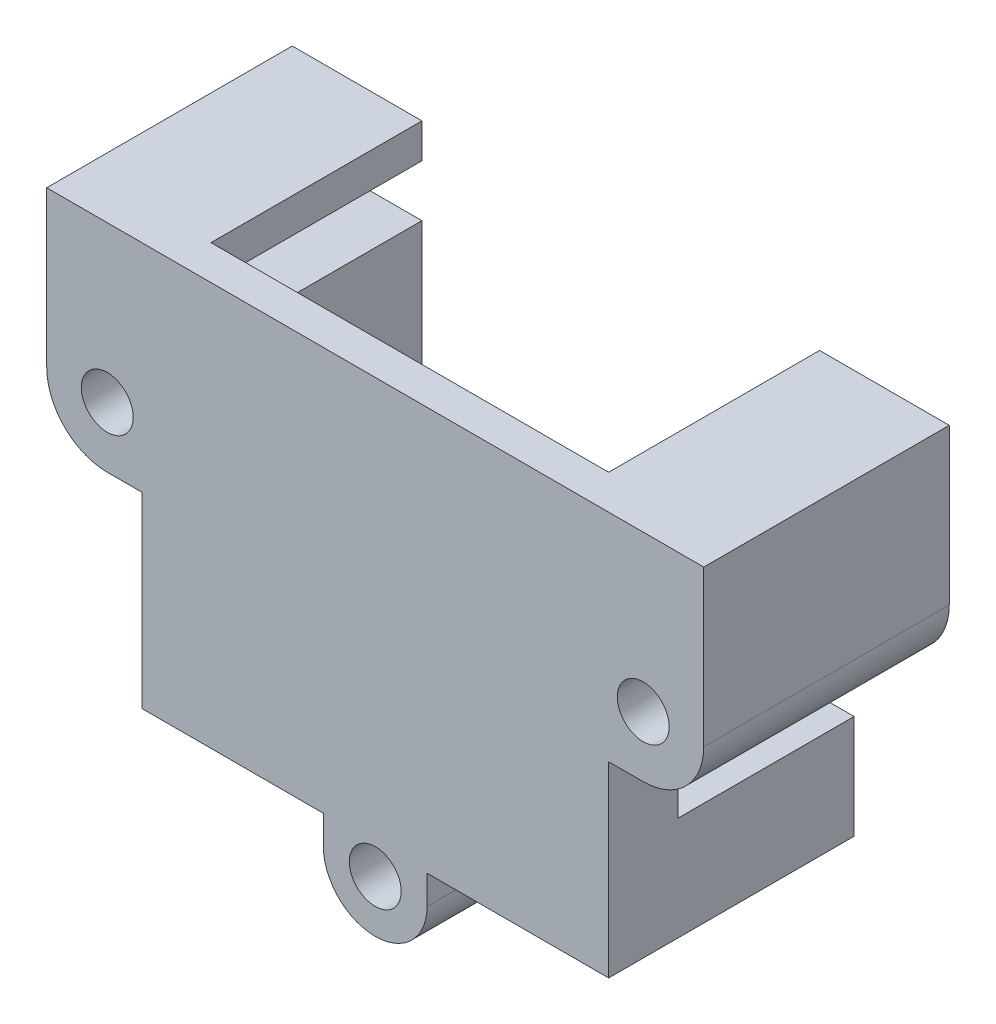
SolidWorks part; units mm, degrees
ref_plane "Alzado" through (0, 0, 0) normal (0, 0, 1) x (1, 0, 0)
ref_plane "Planta" through (0, 0, 0) normal (0, 1, 0) x (1, 0, 0)
ref_plane "Vista lateral" through (0, 0, 0) normal (1, 0, 0) x (0, 0, -1)
sketch "Croquis1" plane through (0, 0, 0) normal (0, 0, 1) x (1, 0, 0)
  line L22 (11.5, 17.5) -> (11.5, 8.5)
  line L23 (17, 17.5) -> (11.5, 17.5)
  line L24 (17, 20.5) -> (17, 17.5)
  line L25 (19, 15.5) -> (19, 20.5)
  line L26 (17.5, 15.5) -> (19, 15.5)
  line L27 (17.5, 13.5) -> (17.5, 15.5)
  line L28 (13.5, 11.5) -> (15.5, 11.5)
  line L29 (11.5, 8.5) -> (13.5, 8.5)
  line L30 (-17, 17.5) -> (-17, 20.5)
  line L31 (-11.5, 17.5) -> (-17, 17.5)
  line L32 (-11.5, 0.5) -> (-11.5, 17.5)
  line L33 (11.5, 0.5) -> (-11.5, 0.5)
  line L34 (11.5, 5.1667) -> (11.5, 0.5)
  line L35 (13.5, 5.1667) -> (11.5, 5.1667)
  line L36 (13.5, -0.8333) -> (13.5, 5.1667)
  line L37 (1.8856, -0.8333) -> (13.5, -0.8333)
  line L38 (-13.5, -0.8333) -> (-1.8856, -0.8333)
  line L39 (-13.5, 11.5) -> (-13.5, -0.8333)
  line L40 (-15.5, 11.5) -> (-13.5, 11.5)
  line L41 (-17.5, 15.5) -> (-17.5, 13.5)
  line L42 (-19, 15.5) -> (-17.5, 15.5)
  line L43 (-19, 20.5) -> (-19, 15.5)
  line L44 (-19, 20.5) -> (-19, 22.5)
  line L46 (-19, 22.5) -> (-11.5, 22.5)
  line L47 (-11.5, 22.5) -> (-11.5, 20.5)
  line L48 (-11.5, 20.5) -> (-17, 20.5)
  line L49 (19, 20.5) -> (19, 22.5)
  line L51 (19, 22.5) -> (11.5, 22.5)
  line L52 (11.5, 22.5) -> (11.5, 20.5)
  line L53 (11.5, 20.5) -> (17, 20.5)
  line L54 (13.5, 11.5) -> (13.5, 8.5)
  arc A3 (15.5, 11.5) -> (17.5, 13.5) centre (15.5, 13.5) ccw
  arc A4 (-1.8856, -0.8333) -> (1.8856, -0.8333) centre (0, -1.5) ccw
  arc A5 (-17.5, 13.5) -> (-15.5, 11.5) centre (-15.5, 13.5) ccw
  circle A9 centre (15.5, 13.5) radius 1
  circle A10 centre (0, -1.5) radius 1
  circle A11 centre (-15.5, 13.5) radius 1
extrude "Saliente-Extruir1" add sketch "Croquis1" along normal blind 8
sketch "Croquis3" plane through (0, 0, 8) normal (0, 0, 1) x (1, 0, 0)
  line L0 (19, 22.5) -> (11.5, 22.5) construction
  line L1 (19, 15.5) -> (19, 22.5) construction
  line L2 (17.5, 15.5) -> (19, 15.5) construction
  line L3 (17.5, 13.5) -> (17.5, 15.5) construction
  line L4 (13.5, 11.5) -> (15.5, 11.5) construction
  line L5 (13.5, 8.5) -> (13.5, 11.5) construction
  line L6 (13.5, -0.8333) -> (13.5, 5.1667) construction
  line L7 (1.8856, -0.8333) -> (13.5, -0.8333) construction
  line L8 (-13.5, -0.8333) -> (-1.8856, -0.8333) construction
  line L9 (-13.5, 11.5) -> (-13.5, -0.8333) construction
  line L10 (-15.5, 11.5) -> (-13.5, 11.5) construction
  line L11 (-17.5, 15.5) -> (-17.5, 13.5) construction
  line L12 (-19, 15.5) -> (-17.5, 15.5) construction
  line L13 (-19, 22.5) -> (-19, 15.5) construction
  line L14 (-11.5, 22.5) -> (-19, 22.5) construction
  line L15 (19, 22.5) -> (11.5, 22.5)
  line L16 (19, 15.5) -> (19, 22.5)
  line L17 (17.5, 15.5) -> (19, 15.5)
  line L18 (17.5, 13.5) -> (17.5, 15.5)
  line L19 (13.5, 11.5) -> (15.5, 11.5)
  line L20 (13.5, 8.5) -> (13.5, 11.5)
  line L21 (13.5, -0.8333) -> (13.5, 5.1667)
  line L22 (1.8856, -0.8333) -> (13.5, -0.8333)
  line L23 (-13.5, -0.8333) -> (-1.8856, -0.8333)
  line L24 (-13.5, 11.5) -> (-13.5, -0.8333)
  line L25 (-15.5, 11.5) -> (-13.5, 11.5)
  line L26 (-17.5, 15.5) -> (-17.5, 13.5)
  line L27 (-19, 15.5) -> (-17.5, 15.5)
  line L28 (-19, 22.5) -> (-19, 15.5)
  line L29 (-11.5, 22.5) -> (-19, 22.5)
  line L30 (-11.5, 22.5) -> (11.5, 22.5)
  line L31 (13.5, 8.5) -> (13.5, 5.1667)
  circle A0 centre (15.5, 13.5) radius 1 construction
  circle A1 centre (0, -1.5) radius 1 construction
  circle A2 centre (-15.5, 13.5) radius 1 construction
  arc A3 (15.5, 11.5) -> (17.5, 13.5) centre (15.5, 13.5) ccw construction
  arc A4 (-1.8856, -0.8333) -> (1.8856, -0.8333) centre (0, -1.5) ccw construction
  arc A5 (-17.5, 13.5) -> (-15.5, 11.5) centre (-15.5, 13.5) ccw construction
  circle A6 centre (15.5, 13.5) radius 1
  circle A7 centre (0, -1.5) radius 1
  circle A8 centre (-15.5, 13.5) radius 1
  arc A9 (15.5, 11.5) -> (17.5, 13.5) centre (15.5, 13.5) ccw
  arc A10 (-1.8856, -0.8333) -> (1.8856, -0.8333) centre (0, -1.5) ccw
  arc A11 (-17.5, 13.5) -> (-15.5, 11.5) centre (-15.5, 13.5) ccw
extrude "Saliente-Extruir2" add sketch "Croquis3" along normal blind 2
sketch "Croquis5" plane through (0, 0, 8) normal (0, 0, -1) x (-1, 0, 0)
  line L0 (-11.5, 8.5) -> (-11.5, 5.1667)
  line L1 (-11.5, 5.1667) -> (-13.5, 5.1667)
  line L2 (-13.5, 5.1667) -> (-13.5, 8.5)
  line L3 (-13.5, 8.5) -> (-11.5, 8.5)
extrude "Saliente-Extruir3" add sketch "Croquis5" along normal blind 2
sketch "Croquis6" plane through (0, 0, 0) normal (0, 0, -1) x (-1, 0, 0)
  line L0 (17, 17.5) -> (11.5, 17.5) construction
  line L1 (11.5, 17.5) -> (11.5, 0.5) construction
  line L2 (11.5, 0.5) -> (-11.5, 0.5) construction
  line L3 (-11.5, 0.5) -> (-11.5, 5.1667) construction
  line L4 (-11.5, 5.1667) -> (-13.5, 5.1667) construction
  line L5 (-13.5, 5.1667) -> (-13.5, -0.8333) construction
  line L6 (-13.5, -0.8333) -> (-1.8856, -0.8333) construction
  line L7 (1.8856, -0.8333) -> (13.5, -0.8333) construction
  line L8 (13.5, -0.8333) -> (13.5, 11.5) construction
  line L9 (13.5, 11.5) -> (15.5, 11.5) construction
  line L10 (17.5, 13.5) -> (17.5, 15.5) construction
  line L11 (17.5, 15.5) -> (19, 15.5) construction
  line L12 (19, 15.5) -> (19, 22.5) construction
  line L13 (19, 22.5) -> (11.5, 22.5) construction
  line L14 (11.5, 22.5) -> (11.5, 20.5) construction
  line L15 (11.5, 20.5) -> (17, 20.5) construction
  line L16 (17, 20.5) -> (17, 17.5) construction
  line L17 (-11.5, 17.5) -> (-17, 17.5) construction
  line L18 (-17, 17.5) -> (-17, 20.5) construction
  line L19 (-17, 20.5) -> (-11.5, 20.5) construction
  line L20 (-11.5, 20.5) -> (-11.5, 22.5) construction
  line L21 (-11.5, 22.5) -> (-19, 22.5) construction
  line L22 (-19, 22.5) -> (-19, 15.5) construction
  line L23 (-19, 15.5) -> (-17.5, 15.5) construction
  line L24 (-17.5, 15.5) -> (-17.5, 13.5) construction
  line L25 (-15.5, 11.5) -> (-13.5, 11.5) construction
  line L26 (-13.5, 11.5) -> (-13.5, 8.5) construction
  line L27 (-13.5, 8.5) -> (-11.5, 8.5) construction
  line L28 (-11.5, 8.5) -> (-11.5, 17.5) construction
  line L29 (17, 17.5) -> (11.5, 17.5)
  line L30 (11.5, 17.5) -> (11.5, 0.5)
  line L31 (11.5, 0.5) -> (-11.5, 0.5)
  line L32 (-11.5, 0.5) -> (-11.5, 5.1667)
  line L33 (-11.5, 5.1667) -> (-13.5, 5.1667)
  line L34 (-13.5, 5.1667) -> (-13.5, -0.8333)
  line L35 (-13.5, -0.8333) -> (-1.8856, -0.8333)
  line L36 (1.8856, -0.8333) -> (13.5, -0.8333)
  line L37 (13.5, -0.8333) -> (13.5, 11.5)
  line L38 (13.5, 11.5) -> (15.5, 11.5)
  line L39 (17.5, 13.5) -> (17.5, 15.5)
  line L40 (17.5, 15.5) -> (19, 15.5)
  line L41 (19, 15.5) -> (19, 22.5)
  line L42 (19, 22.5) -> (11.5, 22.5)
  line L43 (11.5, 22.5) -> (11.5, 20.5)
  line L44 (11.5, 20.5) -> (17, 20.5)
  line L45 (17, 20.5) -> (17, 17.5)
  line L46 (-11.5, 17.5) -> (-17, 17.5)
  line L47 (-17, 17.5) -> (-17, 20.5)
  line L48 (-17, 20.5) -> (-11.5, 20.5)
  line L49 (-11.5, 20.5) -> (-11.5, 22.5)
  line L50 (-11.5, 22.5) -> (-19, 22.5)
  line L51 (-19, 22.5) -> (-19, 15.5)
  line L52 (-19, 15.5) -> (-17.5, 15.5)
  line L53 (-17.5, 15.5) -> (-17.5, 13.5)
  line L54 (-15.5, 11.5) -> (-13.5, 11.5)
  line L55 (-13.5, 11.5) -> (-13.5, 8.5)
  line L56 (-13.5, 8.5) -> (-11.5, 8.5)
  line L57 (-11.5, 8.5) -> (-11.5, 17.5)
  arc A0 (-1.8856, -0.8333) -> (1.8856, -0.8333) centre (0, -1.5) ccw construction
  arc A1 (15.5, 11.5) -> (17.5, 13.5) centre (15.5, 13.5) ccw construction
  arc A2 (-17.5, 13.5) -> (-15.5, 11.5) centre (-15.5, 13.5) ccw construction
  arc A3 (-1.8856, -0.8333) -> (1.8856, -0.8333) centre (0, -1.5) ccw
  arc A4 (15.5, 11.5) -> (17.5, 13.5) centre (15.5, 13.5) ccw
  arc A5 (-17.5, 13.5) -> (-15.5, 11.5) centre (-15.5, 13.5) ccw
extrude "Saliente-Extruir4" add sketch "Croquis6" along normal blind 4.2
sketch "Croquis7" plane through (0, 0, -4.2) normal (0, 0, -1) x (-1, 0, 0)
  line L0 (-19, 22.5) -> (-19, 15.5) construction
  line L2 (-19, 13.5) -> (-19, 15.5)
  line L3 (-19, 15.5) -> (-18.3723, 15.5)
  line L4 (-19, 15.5) -> (-17.5, 15.5) construction
  line L5 (-15.5, 10) -> (-13.5, 10)
  line L6 (-13.5, 11.5) -> (-13.5, 8.5) construction
  line L7 (-13.5, 10) -> (-13.5, 10.6277)
  line L8 (0, -3.5) -> (0, 26.356) construction
  line L9 (13.5, 10) -> (13.5, 10.6277)
  line L10 (15.5, 10) -> (13.5, 10)
  line L11 (19, 15.5) -> (18.3723, 15.5)
  line L12 (19, 13.5) -> (19, 15.5)
  arc A0 (-13.5, 10.6277) -> (-18.3723, 15.5) centre (-15.5, 13.5) ccw
  arc A2 (-19, 13.5) -> (-15.5, 10) centre (-15.5, 13.5) ccw
  arc A3 (-1.8856, -0.8333) -> (1.8856, -0.8333) centre (0, -1.5) ccw construction
  arc A4 (19, 13.5) -> (15.5, 10) centre (15.5, 13.5) cw
  arc A5 (13.5, 10.6277) -> (18.3723, 15.5) centre (15.5, 13.5) cw
  point P31 (0, 0)
  point P43 (0, 0)
  point P45 (2.5102, -0.8571)
extrude "Saliente-Extruir7" add sketch "Croquis7" against normal up to surface (14.2 mm away)
sketch "Croquis9" plane through (0, 0, -4.2) normal (0, 0, -1) x (-1, 0, 0)
  line L0 (11.5, 0.5) -> (-11.5, 0.5) construction
  line L1 (0, 0) -> (0, -7.42) construction
  line L2 (-3, -2.5) -> (-3, 0.5)
  line L3 (-3, 0.5) -> (3, 0.5)
  line L4 (3, 0.5) -> (3, -2.5)
  arc A0 (-3, -2.5) -> (3, -2.5) centre (0, -2.5) ccw
  dimension "D1" = 6
extrude "Saliente-Extruir8" add sketch "Croquis9" against normal up to surface (14.2 mm away)
sketch "Croquis10" plane through (0, 0, -4.2) normal (0, 0, -1) x (-1, 0, 0)
  circle A0 centre (-15.5, 13.5) radius 1.5
  circle A1 centre (0, -2.5) radius 1.5
  circle A2 centre (15.5, 13.5) radius 1.5
  dimension "D1" = 3
extrude "Cortar-Extruir3" cut sketch "Croquis10" against normal through all both and the other way through all
